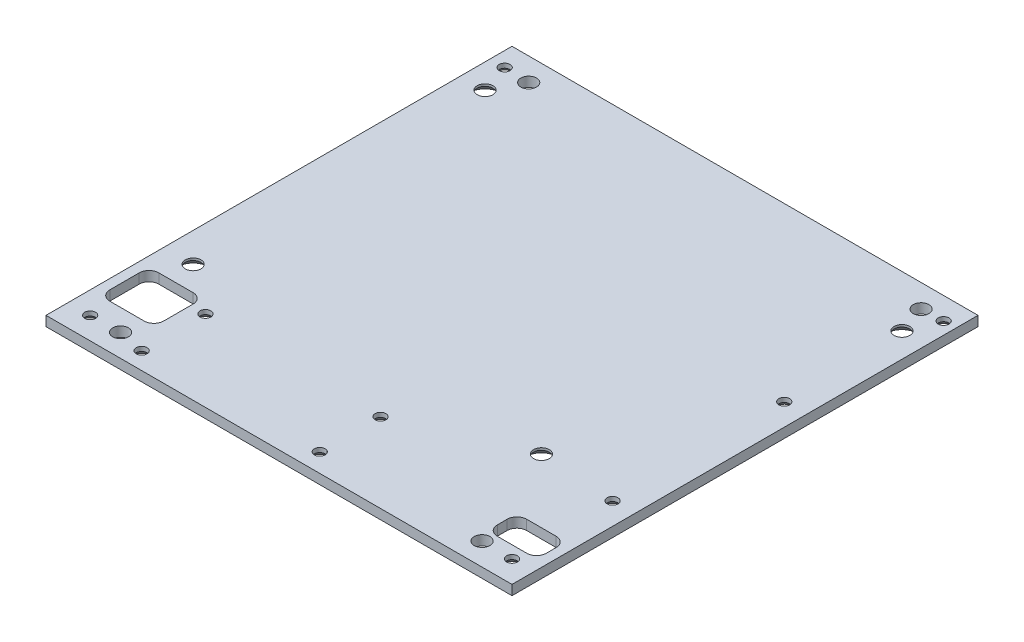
SolidWorks part; units mm, degrees
ref_plane "Front Plane" through (0, 0, 0) normal (0, 0, 1) x (1, 0, 0)
ref_plane "Top Plane" through (0, 0, 0) normal (0, 1, 0) x (1, 0, 0)
ref_plane "Right Plane" through (0, 0, 0) normal (1, 0, 0) x (0, 0, -1)
sketch "Sketch1" plane through (0, 0, 0) normal (0, 1, 0) x (1, 0, 0)
  line L1 (47.5, 47.5) -> (-47.5, 47.5)
  line L2 (47.5, 47.5) -> (47.5, -47.5)
  line L3 (47.5, -47.5) -> (-47.5, -47.5)
  line L4 (-47.5, 47.5) -> (-47.5, -47.5)
  line L5 (47.5, 47.5) -> (-47.5, -47.5) construction
  line L6 (47.5, -47.5) -> (-47.5, 47.5) construction
  point P0 (0, 0)
  dimension "D1" = 95
  dimension "D2" = 95
extrude "Boss-Extrude1" add sketch "Sketch1" along normal blind 2
hole_wizard "CSK for M3 Countersunk Flat Head Screw1" positions "Sketch3" profile "Sketch2" countersink size "M3" standard "ISO"
sketch "Sketch3" plane through (0, 0, 0) normal (0, -1, 0) x (-1, 0, 0)
  line L0 (47.5, -47.5) -> (-47.5, -47.5) construction
  line L1 (47.5, 47.5) -> (47.5, -47.5) construction
  line L2 (-47.5, 47.5) -> (47.5, 47.5) construction
  line L3 (-47.5, -47.5) -> (-47.5, 47.5) construction
  point P0 (41.5, -23.5)
  point P2 (42.5, 37)
  point P4 (-42.5, 37)
  point P6 (-27.5, -21.5)
  dimension "D1" = 24
  dimension "D2" = 6
  dimension "D3" = 10.5
  dimension "D4" = 5
  dimension "D5" = 10.5
  dimension "D6" = 5
  dimension "D7" = 26
  dimension "D9" = 20
sketch "Sketch2" plane through (-41.5, 0, 23.5) normal (1, 0, 0) x (0, 0, -1)
  line L0 (0, 0) -> (0, 2)
  line L1 (0, 2) -> (1.6, 2)
  line L2 (1.6, 2) -> (1.6, 1.55)
  line L3 (1.6, 1.55) -> (3.15, 0)
  line L5 (3.15, 0) -> (0, 0)
  line L6 (-1.6, 1.55) -> (-3.15, 0) construction
  line L11 (0, -6.35) -> (0, 107.95) construction
  dimension "Thru Hole Dia." = 3.2
  dimension "Thru Hole Depth" = 2
  dimension "Near C'Sink Dia." = 6.3
  dimension "Near C'Sink Angle" = 90
hole_wizard "CSK for M2 Countersunk Flat Head Screw1" positions "Sketch5" profile "Sketch4" countersink size "M2" standard "ISO"
sketch "Sketch5" plane through (0, 0, 0) normal (0, -1, 0) x (-1, 0, 0)
  line L1 (47.5, -47.5) -> (-47.5, -47.5) construction
  line L2 (47.5, 47.5) -> (47.5, -47.5) construction
  point P0 (31.5, -44)
  point P2 (31.5, -31)
  point P4 (-4.5, -31.3)
  point P6 (-4.4987, -43.7)
  dimension "D1" = 3.5
  dimension "D2" = 3.8
  dimension "D3" = 16
  dimension "D4" = 16
  dimension "D5" = 13
  dimension "D6" = 36
  dimension "D7" = 36
  dimension "D8" = 12.4
sketch "Sketch4" plane through (-31.5, 0, 44) normal (1, 0, 0) x (0, 0, -1)
  line L0 (0, 0) -> (0, 2)
  line L1 (0, 2) -> (1.1, 2)
  line L2 (1.1, 2) -> (1.1, 1.1)
  line L3 (1.1, 1.1) -> (2.2, 0)
  line L5 (2.2, 0) -> (0, 0)
  line L6 (-1.1, 1.1) -> (-2.2, 0) construction
  line L11 (0, -6.35) -> (0, 107.95) construction
  dimension "Thru Hole Dia." = 2.2
  dimension "Thru Hole Depth" = 2
  dimension "Near C'Sink Dia." = 4.4
  dimension "Near C'Sink Angle" = 90
hole_wizard "Ø3.2 (3.2) Diameter Hole1" positions "Sketch7" profile "Sketch6" hole size "Ø3.2" standard "ISO"
sketch "Sketch7" plane through (0, 0, 0) normal (0, -1, 0) x (-1, 0, 0)
  line L0 (-47.5, -47.5) -> (-47.5, 47.5) construction
  line L1 (-47.5, 47.5) -> (47.5, 47.5) construction
  line L2 (47.5, 47.5) -> (47.5, -47.5) construction
  line L3 (47.5, -47.5) -> (-47.5, -47.5) construction
  point P0 (36.9, -42.9)
  point P2 (-36.8, -42.9)
  point P4 (-40.6, 42.8)
  point P6 (39.4, 42.8)
  dimension "D1" = 6.9
  dimension "D2" = 4.7
  dimension "D3" = 8.1
  dimension "D4" = 4.7
  dimension "D5" = 4.6
  dimension "D6" = 10.6
  dimension "D7" = 10.7
  dimension "D8" = 4.6
sketch "Sketch6" plane through (-36.9, 0, 42.9) normal (1, 0, 0) x (0, 0, -1)
  line L0 (0, 0) -> (0, 2)
  line L1 (0, 2) -> (1.6, 2)
  line L2 (1.6, 2) -> (1.6, 0)
  line L5 (1.6, 0) -> (0, 0)
  line L11 (0, -6.35) -> (0, 107.95) construction
  dimension "Thru Hole Dia." = 3.2
  dimension "Thru Hole Depth" = 2
hole_wizard "CSK for M2 Countersunk Flat Head Screw2" positions "Sketch10" profile "Sketch9" countersink size "M2" standard "ISO"
sketch "Sketch10" plane through (0, 0, 0) normal (0, -1, 0) x (-1, 0, 0)
  line L0 (47.5, 47.5) -> (47.5, -47.5) construction
  line L1 (47.5, -47.5) -> (-47.5, -47.5) construction
  line L2 (-47.5, -47.5) -> (-47.5, 47.5) construction
  line L3 (-47.5, 47.5) -> (47.5, 47.5) construction
  point P0 (43, -43)
  point P2 (-43, -43)
  point P4 (44.5, 43)
  point P6 (-45, 43)
  dimension "D1" = 4.5
  dimension "D2" = 4.5
  dimension "D3" = 4.5
  dimension "D4" = 4.5
  dimension "D5" = 4.5
  dimension "D6" = 2.5
  dimension "D7" = 3
  dimension "D8" = 4.5
sketch "Sketch9" plane through (-43, 0, 43) normal (1, 0, 0) x (0, 0, -1)
  line L0 (0, 0) -> (0, 2)
  line L1 (0, 2) -> (1.1, 2)
  line L2 (1.1, 2) -> (1.1, 1.1)
  line L3 (1.1, 1.1) -> (2.2, 0)
  line L5 (2.2, 0) -> (0, 0)
  line L6 (-1.1, 1.1) -> (-2.2, 0) construction
  line L11 (0, -6.35) -> (0, 107.95) construction
  dimension "Thru Hole Dia." = 2.2
  dimension "Thru Hole Depth" = 2
  dimension "Near C'Sink Dia." = 4.4
  dimension "Near C'Sink Angle" = 90
sketch "Sketch11" plane through (0, 2, 0) normal (0, 1, 0) x (1, 0, 0)
  line L0 (-47.5, -47.5) -> (47.5, -47.5) construction
  line L1 (37.5, -34.5) -> (43.5, -34.5)
  line L2 (35.5, -36.5) -> (35.5, -38.5)
  line L3 (37.5, -40.5) -> (43.5, -40.5)
  line L4 (45.5, -36.5) -> (45.5, -38.5)
  line L5 (47.5, -47.5) -> (47.5, 47.5) construction
  arc A0 (43.5, -40.5) -> (45.5, -38.5) centre (43.5, -38.5) ccw
  arc A1 (43.5, -34.5) -> (45.5, -36.5) centre (43.5, -36.5) cw
  arc A2 (37.5, -34.5) -> (35.5, -36.5) centre (37.5, -36.5) ccw
  arc A3 (35.5, -38.5) -> (37.5, -40.5) centre (37.5, -38.5) ccw
  point P10 (45.5, -40.5)
  point P13 (45.5, -34.5)
  point P16 (35.5, -34.5)
  dimension "D5" = 2
  dimension "D1" = 7
  dimension "D2" = 2
  dimension "D3" = 6
  dimension "D4" = 10
extrude "Cut-Extrude2" cut sketch "Sketch11" against normal blind 10
sketch "Sketch13" plane through (0, 0, 0) normal (0, -1, 0) x (1, 0, 0)
  line L0 (-47.5, 47.5) -> (47.5, 47.5) construction
  line L1 (-43.5, 38.5) -> (-36.5, 38.5)
  line L2 (-45.5, 36.5) -> (-45.5, 30.5)
  line L3 (-43.5, 28.5) -> (-36.5, 28.5)
  line L4 (-34.5, 36.5) -> (-34.5, 30.5)
  line L5 (-47.5, -47.5) -> (-47.5, 47.5) construction
  arc A0 (-45.5, 30.5) -> (-43.5, 28.5) centre (-43.5, 30.5) ccw
  arc A1 (-36.5, 28.5) -> (-34.5, 30.5) centre (-36.5, 30.5) ccw
  arc A2 (-36.5, 38.5) -> (-34.5, 36.5) centre (-36.5, 36.5) cw
  arc A3 (-43.5, 38.5) -> (-45.5, 36.5) centre (-43.5, 36.5) ccw
  point P10 (-45.5, 28.5)
  point P15 (-34.5, 38.5)
  point P18 (-45.5, 38.5)
  dimension "D5" = 2
  dimension "D1" = 9
  dimension "D2" = 2
  dimension "D3" = 10
  dimension "D4" = 11
extrude "Cut-Extrude3" cut sketch "Sketch13" against normal through all
hole_wizard "CSK for M2 Countersunk Flat Head Screw3" positions "Sketch15" profile "Sketch14" countersink size "M2" standard "ISO"
sketch "Sketch15" plane through (0, 0, 0) normal (0, -1, 0) x (-1, 0, 0)
  line L0 (-47.5, -47.5) -> (-47.5, 47.5) construction
  line L3 (47.5, -47.5) -> (-47.5, -47.5) construction
  point P0 (-43, -22.5)
  point P2 (-43, 12.5)
  dimension "D1" = 4.5
  dimension "D2" = 25
  dimension "D3" = 4.5
  dimension "D4" = 35
sketch "Sketch14" plane through (43, 0, 22.5) normal (1, 0, 0) x (0, 0, -1)
  line L0 (0, 0) -> (0, 2)
  line L1 (0, 2) -> (1.1, 2)
  line L2 (1.1, 2) -> (1.1, 1.1)
  line L3 (1.1, 1.1) -> (2.2, 0)
  line L5 (2.2, 0) -> (0, 0)
  line L6 (-1.1, 1.1) -> (-2.2, 0) construction
  line L11 (0, -6.35) -> (0, 107.95) construction
  dimension "Thru Hole Dia." = 2.2
  dimension "Thru Hole Depth" = 2
  dimension "Near C'Sink Dia." = 4.4
  dimension "Near C'Sink Angle" = 90
